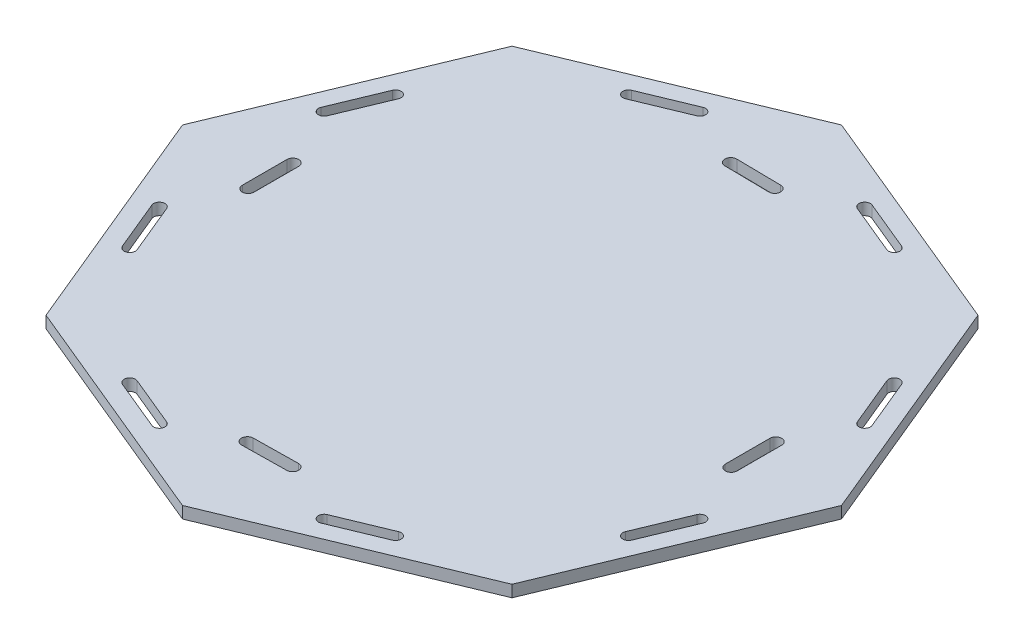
SolidWorks part; units mm, degrees
ref_plane "Front" through (0, 0, 0) normal (0, 0, 1) x (1, 0, 0)
ref_plane "Top" through (0, 0, 0) normal (0, 1, 0) x (1, 0, 0)
ref_plane "Right" through (0, 0, 0) normal (1, 0, 0) x (0, 0, -1)
sketch "Sketch1" plane through (0, 0, 0) normal (0, 1, 0) x (1, 0, 0)
  line L0 (0, 426.0949) -> (0, -435.219) construction
  line L1 (-535.5839, 0) -> (581.2044, 0) construction
  line L2 (-24.3609, 256.738) -> (23.0337, 256.023) construction
  line L3 (0, 350) -> (-247.4874, 247.4874)
  line L4 (-247.4874, 247.4874) -> (-350, 0)
  line L5 (-350, 0) -> (-247.4874, -247.4874)
  line L6 (-247.4874, -247.4874) -> (0, -350)
  line L7 (0, -350) -> (247.4874, -247.4874)
  line L8 (247.4874, -247.4874) -> (350, 0)
  line L9 (350, 0) -> (247.4874, 247.4874)
  line L10 (247.4874, 247.4874) -> (0, 350)
  line L19 (-256.5039, -106.2474) -> (-256.5039, 106.2474) construction
  line L22 (-256.5039, -23.7) -> (-256.5039, 23.7) construction
  line L25 (256.5039, -23.7) -> (256.5039, 23.7) construction
  line L28 (123.7437, -298.7437) -> (-123.7437, 298.7437) construction
  line L29 (123.7437, 298.7437) -> (-123.7437, -298.7437) construction
  line L30 (298.7437, -123.7437) -> (-298.7437, 123.7437) construction
  line L33 (298.7437, 123.7437) -> (-298.7437, -123.7437) construction
  line L36 (141.1168, 264.9054) -> (87.5318, 287.101) construction
  line L45 (138.8207, 259.3621) -> (85.2357, 281.5577)
  line L54 (-87.5318, 287.101) -> (-141.1168, 264.9054) construction
  line L57 (143.4129, 270.4486) -> (89.8279, 292.6443)
  line L60 (287.101, 87.5318) -> (264.9054, 141.1168) construction
  line L63 (-85.2357, 281.5577) -> (-138.8207, 259.3621)
  line L66 (281.5577, 85.2357) -> (259.3621, 138.8207)
  line L69 (292.6443, 89.8279) -> (270.4486, 143.4129)
  line L72 (-89.8279, 292.6443) -> (-143.4129, 270.4486)
  line L73 (264.9054, -141.1168) -> (287.101, -87.5318) construction
  line L76 (-247.4874, 247.4874) -> (247.4874, -247.4874) construction
  line L77 (350, 0) -> (247.4874, -247.4874) construction
  line L78 (-228.6485, 228.6485) -> (0, 323.3578) construction
  line L79 (-228.6485, 228.6485) -> (-323.3578, 0) construction
  line L80 (259.3621, -138.8207) -> (281.5577, -85.2357)
  line L81 (270.4486, -143.4129) -> (292.6443, -89.8279)
  line L82 (87.5318, -287.101) -> (141.1168, -264.9054) construction
  line L83 (85.2357, -281.5577) -> (138.8207, -259.3621)
  line L84 (89.8279, -292.6443) -> (143.4129, -270.4486)
  line L85 (-141.1168, -264.9054) -> (-87.5318, -287.101) construction
  line L86 (-138.8207, -259.3621) -> (-85.2357, -281.5577)
  line L87 (-143.4129, -270.4486) -> (-89.8279, -292.6443)
  line L88 (-287.101, -87.5318) -> (-264.9054, -141.1168) construction
  line L89 (-281.5577, -85.2357) -> (-259.3621, -138.8207)
  line L90 (-292.6443, -89.8279) -> (-270.4486, -143.4129)
  line L91 (-264.9054, 141.1168) -> (-287.101, 87.5318) construction
  line L92 (-259.3621, 138.8207) -> (-281.5577, 85.2357)
  line L93 (-270.4486, 143.4129) -> (-292.6443, 89.8279)
  line L94 (-138.8207, -259.3621) -> (119.6527, -366.4253) construction
  line L95 (-143.4129, -270.4486) -> (115.33, -374.8763) construction
  line L96 (138.8207, -259.3621) -> (-93.4166, -353.3721) construction
  line L97 (143.4129, -270.4486) -> (-110.1546, -374.8763) construction
  line L98 (-24.2659, 263.0373) -> (23.1287, 262.3223)
  line L99 (-106.8599, 257.9826) -> (105.5327, 254.7785) construction
  line L100 (-24.4559, 250.4388) -> (22.9387, 249.7238)
  line L101 (-262.8039, -23.7) -> (-262.8039, 23.7)
  line L102 (-250.2039, -23.7) -> (-250.2039, 23.7)
  line L103 (262.8039, -23.7) -> (262.8039, 23.7)
  line L104 (250.2039, -23.7) -> (250.2039, 23.7)
  line L105 (-24.3609, -256.738) -> (23.0337, -256.023) construction
  line L106 (-24.2659, -263.0373) -> (23.1287, -262.3223)
  line L107 (-24.4559, -250.4388) -> (22.9387, -249.7238)
  circle A0 centre (0, 0) radius 323.3578 construction
  arc A45 (-85.2357, 281.5577) -> (-89.8279, 292.6443) centre (-87.5318, 287.101) ccw
  arc A46 (-143.4129, 270.4486) -> (-138.8207, 259.3621) centre (-141.1168, 264.9054) ccw
  arc A47 (138.8207, 259.3621) -> (143.4129, 270.4486) centre (141.1168, 264.9054) ccw
  arc A48 (89.8279, 292.6443) -> (85.2357, 281.5577) centre (87.5318, 287.101) ccw
  arc A49 (281.5577, 85.2357) -> (292.6443, 89.8279) centre (287.101, 87.5318) ccw
  arc A50 (270.4486, 143.4129) -> (259.3621, 138.8207) centre (264.9054, 141.1168) ccw
  arc A51 (259.3621, -138.8207) -> (270.4486, -143.4129) centre (264.9054, -141.1168) ccw
  arc A52 (292.6443, -89.8279) -> (281.5577, -85.2357) centre (287.101, -87.5318) ccw
  arc A53 (85.2357, -281.5577) -> (89.8279, -292.6443) centre (87.5318, -287.101) ccw
  arc A54 (143.4129, -270.4486) -> (138.8207, -259.3621) centre (141.1168, -264.9054) ccw
  arc A55 (-138.8207, -259.3621) -> (-143.4129, -270.4486) centre (-141.1168, -264.9054) ccw
  arc A56 (-89.8279, -292.6443) -> (-85.2357, -281.5577) centre (-87.5318, -287.101) ccw
  arc A57 (-281.5577, -85.2357) -> (-292.6443, -89.8279) centre (-287.101, -87.5318) ccw
  arc A58 (-270.4486, -143.4129) -> (-259.3621, -138.8207) centre (-264.9054, -141.1168) ccw
  arc A59 (-259.3621, 138.8207) -> (-270.4486, 143.4129) centre (-264.9054, 141.1168) ccw
  arc A60 (-292.6443, 89.8279) -> (-281.5577, 85.2357) centre (-287.101, 87.5318) ccw
  arc A61 (-24.2659, 263.0373) -> (-24.4559, 250.4388) centre (-24.3609, 256.738) ccw
  arc A62 (22.9387, 249.7238) -> (23.1287, 262.3223) centre (23.0337, 256.023) ccw
  arc A63 (-262.8039, -23.7) -> (-250.2039, -23.7) centre (-256.5039, -23.7) ccw
  arc A64 (-250.2039, 23.7) -> (-262.8039, 23.7) centre (-256.5039, 23.7) ccw
  arc A65 (262.8039, -23.7) -> (250.2039, -23.7) centre (256.5039, -23.7) cw
  arc A66 (250.2039, 23.7) -> (262.8039, 23.7) centre (256.5039, 23.7) cw
  arc A67 (-24.2659, -263.0373) -> (-24.4559, -250.4388) centre (-24.3609, -256.738) cw
  arc A68 (22.9387, -249.7238) -> (23.1287, -262.3223) centre (23.0337, -256.023) cw
  point P33 (-0.6636, 256.3805)
  point P42 (-256.5039, 0)
  point P46 (-30.6602, 256.8331)
  point P48 (-256.5039, 30)
  point P49 (-256.5039, -30)
  point P53 (256.5039, 0)
  point P60 (-0.6636, -256.3805)
  point P73 (114.3243, 276.0032)
  point P80 (276.0032, 114.3243)
  point P85 (-114.3243, 276.0032)
  point P94 (276.0032, -114.3243)
  point P101 (114.3243, -276.0032)
  point P108 (-114.3243, -276.0032)
  point P115 (-276.0032, -114.3243)
  point P123 (-276.0032, 114.3243)
  point P126 (29.333, 255.928)
  point P129 (-81.9885, 289.3971)
  point P130 (-146.66, 262.6093)
  point P131 (0, 0)
  dimension "D6" = 60
  dimension "D8" = 60
  dimension "D9" = 6
  dimension "D10" = 8
  dimension "D5" = 6.3
  dimension "D7" = 6.3
  dimension "D1" = 700
  dimension "D14" = 70
extrude "Boss-Extrude1" add sketch "Sketch1" along normal blind 12.5
